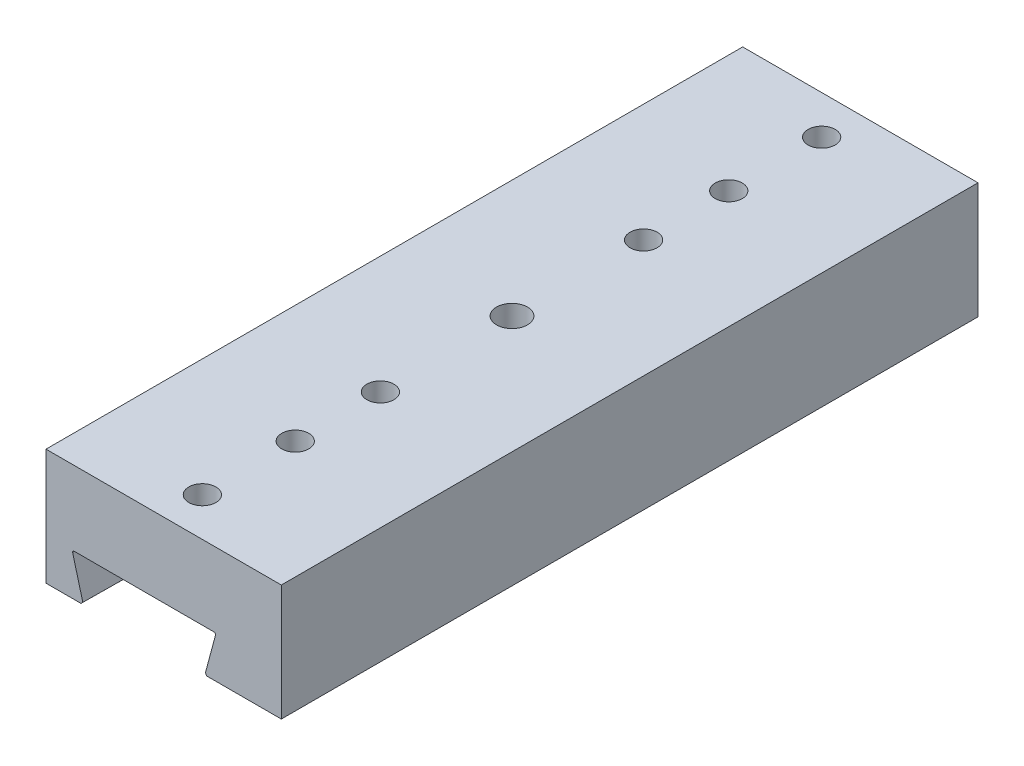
SolidWorks part; units mm, degrees
ref_plane "Plan de face" through (0, 0, 0) normal (0, 0, 1) x (1, 0, 0)
ref_plane "Plan de dessus" through (0, 0, 0) normal (0, 1, 0) x (1, 0, 0)
ref_plane "Plan de droite" through (0, 0, 0) normal (1, 0, 0) x (0, 0, -1)
sketch "Esquisse1" plane through (0, 0, 0) normal (0, 0, 1) x (1, 0, 0)
  line L1 (-76, 0) -> (76, 0)
  line L2 (-76, 0) -> (-76, -75)
  line L3 (-76, -75) -> (76, -75)
  line L4 (76, 0) -> (76, -75)
  dimension "D1" = 75
  dimension "D2" = 152
extrude "Boss.-Extru.1" add sketch "Esquisse1" along normal mid plane 450
sketch "Esquisse2" plane through (0, 0, -225) normal (0, 0, -1) x (-1, 0, 0)
  line L0 (47.4, -75) -> (-26.6, -75)
  line L1 (76, -75) -> (-76, -75) construction
  line L2 (-26.6, -75) -> (-33.8346, -48)
  line L3 (-33.8346, -48) -> (54.6346, -48)
  line L4 (54.6346, -48) -> (47.4, -75)
  line L5 (-33.8346, -48) -> (-33.8346, -66.636) construction
  line L6 (54.6346, -48) -> (54.6346, -66.636) construction
  dimension "D1" = 15
  dimension "D2" = 15
  dimension "D3" = 26.6
  dimension "D4" = 27
  dimension "D5" = 74
sketch "Esquisse3" plane through (0, 0, 225) normal (0, 0, 1) x (1, 0, 0)
  line L0 (-54.6346, -48) -> (-47.4, -75) construction
  line L4 (-47.4, -75) -> (26.6, -75)
  line L5 (26.6, -75) -> (33.8346, -48)
  line L6 (33.8346, -48) -> (-54.6346, -48)
  line L7 (-54.6346, -48) -> (-47.4, -75)
  line L8 (-51.9, -75) -> (26.6, -75)
  line L9 (26.6, -75) -> (33.8346, -48)
  line L10 (33.8346, -48) -> (-59.1346, -48)
  line L11 (-59.1346, -48) -> (-51.9, -75)
  dimension "D2" = 4.5
  dimension "D1" = 0
loft "Enlèvement de matière-Lissage1" cut profiles "Esquisse3", "Esquisse2"
hole_wizard "Chambrage pour vis à tête hexagonale M161" positions "Esquisse5" profile "Esquisse4" counterbore size "M16" standard "Iso"
sketch "Esquisse5" plane through (0, -48, 0) normal (0, -1, 0) x (-1, 0, 0)
  line L0 (0, 0) -> (167.0639, 0) construction
  point P0 (0, -85)
  point P2 (0, -140)
  point P4 (0, -200)
  point P10 (0, 200)
  point P11 (0, 140)
  point P12 (0, 85)
  dimension "D1" = 85
  dimension "D2" = 55
  dimension "D3" = 60
sketch "Esquisse4" plane through (0, -48, 85) normal (1, 0, 0) x (0, 0, -1)
  line L0 (0, 0) -> (0, 48)
  line L1 (0, 48) -> (8.75, 48)
  line L3 (8.75, 48) -> (8.75, 20.6)
  line L4 (8.75, 20.6) -> (15, 20.6)
  line L5 (15, 20.6) -> (15, 0)
  line L7 (15, 0) -> (0, 0)
  line L11 (0, -6.35) -> (0, 107.95) construction
  dimension "Diamètre du perçage jusqu'au prochain" = 17.5
  dimension "Profondeur du perçage jusqu'au prochain" = 48
  dimension "Diamètre du chambrage" = 30
  dimension "Profondeur du chambrage" = 20.6
sketch "Esquisse6" plane through (0, -48, 0) normal (0, -1, 0) x (1, 0, 0)
  circle A0 centre (0, 0) radius 10
  dimension "D1" = 20
extrude "Enlèv. mat.-Extru.1" cut sketch "Esquisse6" against normal up to next
fillet "Congé1" radius 1 2 edges
chamfer "Chanfrein1" distance 1.5 angle 45 2 edges
chamfer "Chanfrein2" distance 1 angle 45 1 edges at (0, -48, -10)
equation "\"D2@Esquisse3\" = \"D1@Boss.-Extru.1\" * .01"
